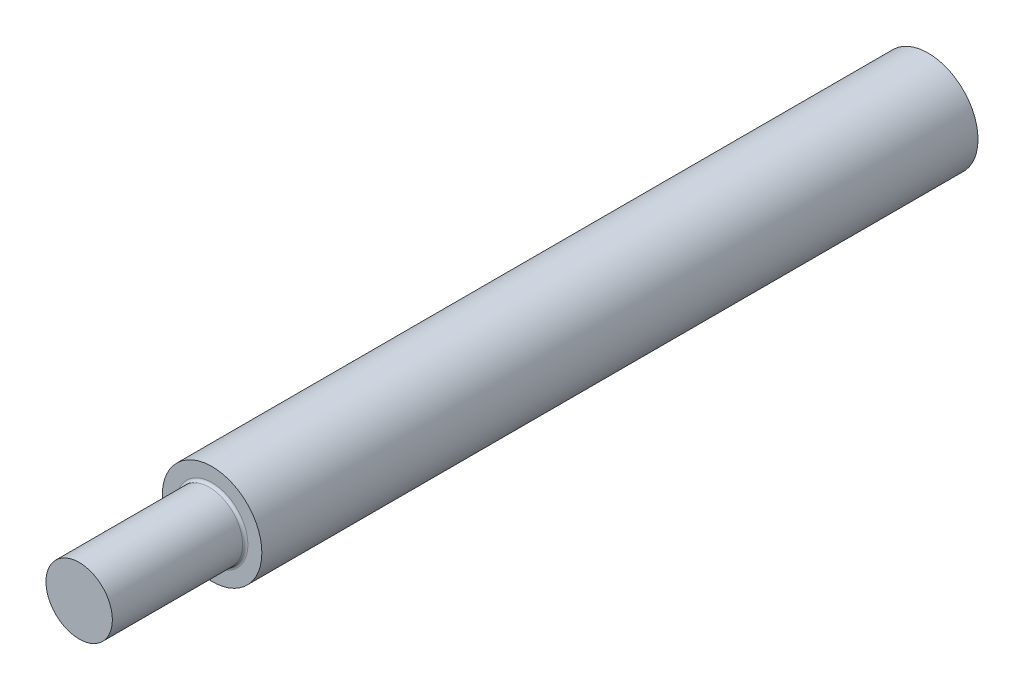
SolidWorks part; units mm, degrees
ref_plane "Front Plane" through (0, 0, 0) normal (0, 0, 1) x (1, 0, 0)
ref_plane "Top Plane" through (0, 0, 0) normal (0, 1, 0) x (1, 0, 0)
ref_plane "Right Plane" through (0, 0, 0) normal (1, 0, 0) x (0, 0, -1)
sketch "Sketch1" plane through (0, 0, 0) normal (0, 0, 1) x (1, 0, 0)
  circle A0 centre (0, 0) radius 4.7625
  dimension "D1" = 9.525
extrude "Boss-Extrude1" add sketch "Sketch1" along normal blind 68.453
sketch "Sketch2" plane through (0, 0, 68.453) normal (0, 0, 1) x (1, 0, 0)
  circle A0 centre (0, 0) radius 3.175
  dimension "D1" = 6.35
extrude "Boss-Extrude2" add sketch "Sketch2" along normal blind 12.7
fillet "Fillet1" radius 0.254 1 edges at (3.175, 0, 68.453)
